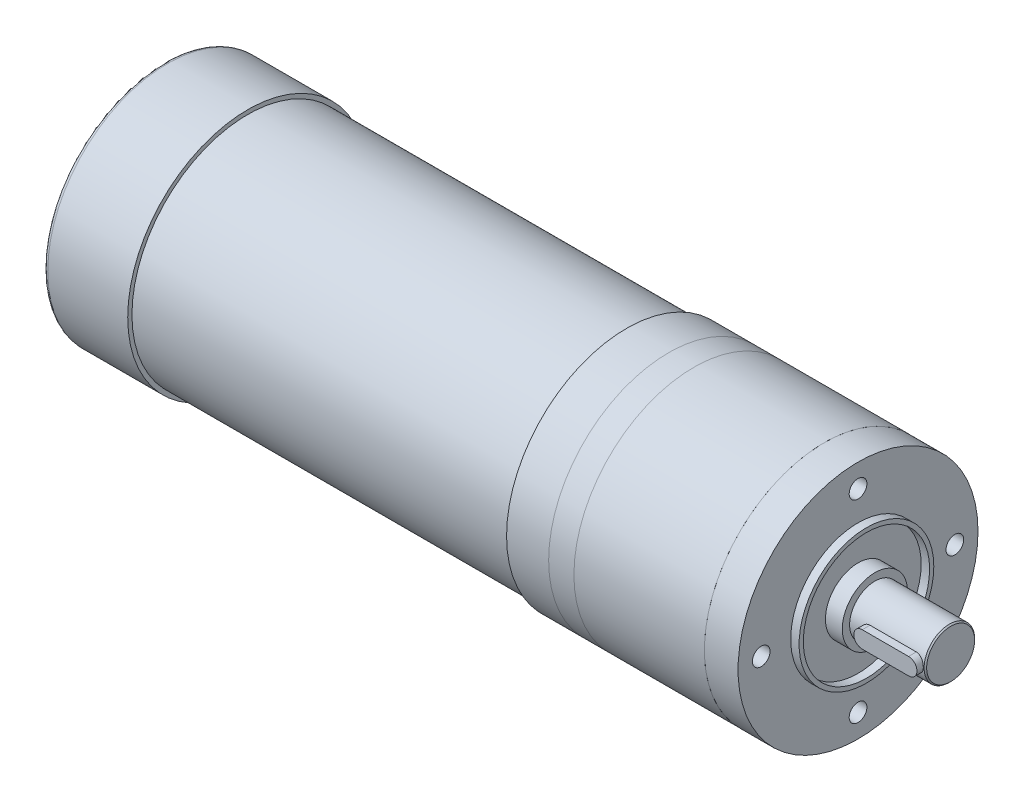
SolidWorks part; units mm, degrees
ref_plane "前视基准面" through (0, 0, 0) normal (0, 0, 1) x (1, 0, 0)
ref_plane "上视基准面" through (0, 0, 0) normal (0, 1, 0) x (1, 0, 0)
ref_plane "右视基准面" through (0, 0, 0) normal (1, 0, 0) x (0, 0, -1)
sketch "草图1" plane through (0, 0, 0) normal (1, 0, 0) x (0, 0, -1)
  circle A0 centre (0, 0) radius 28.5
extrude "凸台-拉伸1" add sketch "草图1" against normal blind 8
sketch "草图2" plane through (-8, 0, 0) normal (-1, 0, 0) x (0, 0, 1)
  circle A0 centre (0, 0) radius 28.5
extrude "凸台-拉伸2" add sketch "草图2" along normal blind 31 separate body
sketch "草图3" plane through (-39, 0, 0) normal (-1, 0, 0) x (0, 0, 1)
  circle A0 centre (0, 0) radius 28.5
extrude "凸台-拉伸3" add sketch "草图3" along normal blind 6 separate body
sketch "草图4" plane through (-45, 0, 0) normal (-1, 0, 0) x (0, 0, 1)
  circle A0 centre (0, 0) radius 28.5
extrude "凸台-拉伸4" add sketch "草图4" along normal blind 10 separate body
sketch "草图5" plane through (-55, 0, 0) normal (-1, 0, 0) x (0, 0, 1)
  circle A0 centre (0, 0) radius 27.5
extrude "凸台-拉伸5" add sketch "草图5" along normal blind 90
sketch "草图6" plane through (-145, 0, 0) normal (-1, 0, 0) x (0, 0, 1)
  circle A0 centre (0, 0) radius 28.5
extrude "凸台-拉伸6" add sketch "草图6" along normal blind 20
fillet "圆角1" radius 1 1 edges at (-165, 0, 28.5)
sketch "草图7" plane through (0, 0, 0) normal (1, 0, 0) x (0, 0, -1)
  circle A0 centre (0, 0) radius 16
  circle A1 centre (0, 0) radius 15
extrude "凸台-拉伸7" add sketch "草图7" along normal blind 2
sketch "草图8" plane through (0, 0, 0) normal (1, 0, 0) x (0, 0, -1)
  circle A0 centre (0, 0) radius 7.75
extrude "凸台-拉伸8" add sketch "草图8" along normal blind 4
sketch "草图9" plane through (4, 0, 0) normal (1, 0, 0) x (0, 0, -1)
  circle A0 centre (0, 0) radius 6
extrude "凸台-拉伸9" add sketch "草图9" along normal blind 18
sketch "草图10" plane through (0, 0, 0) normal (1, 0, 0) x (0, 0, -1)
  point P3 (0, 23)
  point P4 (23, 0)
  point P5 (0, -23)
  point P6 (-23, 0)
hole_wizard "M5 螺纹孔1" positions "3D草图1" profile "草图11" tap size "M5" standard "GB"
sketch3d "3D草图1"
  point P0 (0, 23, 0)
  point P3 (0, 0, -23)
  point P6 (0, -23, 0)
  point P9 (0, 0, 23)
sketch "草图11" plane through (0, 23, 0) normal (0, 1, 0) x (0, 0, -1)
  line L0 (0, 0) -> (0, 15.2618)
  line L1 (0, 15.2618) -> (2.1, 14)
  line L2 (2.1, 14) -> (2.1, 0)
  line L5 (2.1, 0) -> (0, 0)
  line L10 (0, 15.2618) -> (-2.1, 14) construction
  line L11 (0, -6.35) -> (0, 107.95) construction
  dimension "螺纹孔钻头直径" = 4.2
  dimension "螺纹孔钻头深度" = 14
  dimension "导头角度" = 118
ref_plane "基准面1" through (0, 0, 6) normal (0, 0, 1) x (1, 0, 0)
sketch "草图12" plane through (0, 0, 6) normal (0, 0, 1) x (1, 0, 0)
  line L3 (8.5, 2) -> (19.5, 2)
  line L5 (19.5, -2) -> (8.5, -2)
  arc A0 (19.5, -2) -> (19.5, 2) centre (19.5, 0) ccw
  arc A1 (8.5, 2) -> (8.5, -2) centre (8.5, 0) ccw
extrude "切除-拉伸1" cut sketch "草图12" against normal blind 2.5
sketch "草图13" plane through (0, 0, 3.5) normal (0, 0, 1) x (1, 0, 0)
  line L0 (8.5, 2) -> (19.5, 2)
  line L2 (19.5, -2) -> (8.5, -2)
  arc A0 (8.5, 2) -> (8.5, -2) centre (8.5, 0) ccw
  arc A1 (19.5, -2) -> (19.5, 2) centre (19.5, 0) ccw
extrude "凸台-拉伸10" add sketch "草图13" along normal blind 4 separate body
chamfer "倒角1" distance 0.3 angle 45 1 edges at (22, 0, -6)
